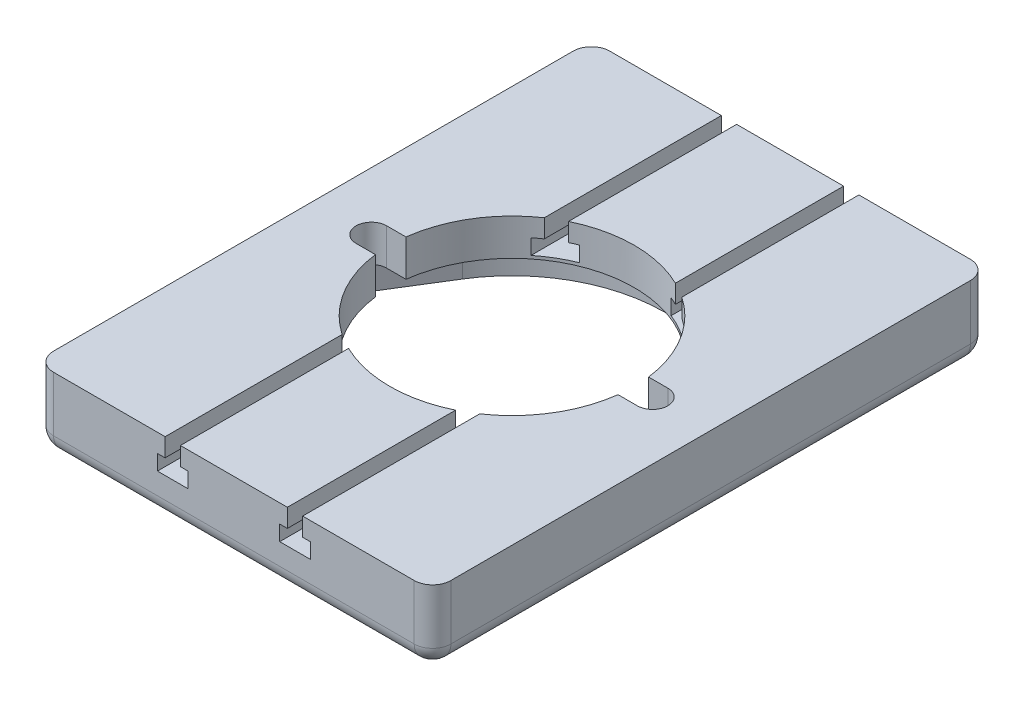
SolidWorks part; units mm, degrees
ref_plane "Plan de face" through (0, 0, 0) normal (0, 0, 1) x (1, 0, 0)
ref_plane "Plan de dessus" through (0, 0, 0) normal (0, 1, 0) x (1, 0, 0)
ref_plane "Plan de droite" through (0, 0, 0) normal (1, 0, 0) x (0, 0, -1)
sketch "Esquisse2" plane through (0, 0, 0) normal (0, 1, 0) x (1, 0, 0)
  line L1 (-325, -455) -> (325, -455)
  line L2 (-325, -455) -> (-325, 455)
  line L3 (-325, 455) -> (325, 455)
  line L4 (325, -455) -> (325, 455)
  line L5 (-325, -455) -> (325, 455) construction
  line L6 (-325, 455) -> (325, -455) construction
  point P0 (0, 0)
  dimension "D1" = 910
  dimension "D2" = 650
extrude "Boss.-Extru.1" add sketch "Esquisse2" against normal blind 120
fillet "Congé1" radius 30 8 edges at (0, -120, -455) (-325, -120, 0) (0, -120, 455) (325, -120, 0) (-325, -60, -455) (325, -60, -455) (325, -60, 455) (-325, -60, 455)
sketch "Esquisse3" plane through (0, 0, 0) normal (0, 1, 0) x (1, 0, 0)
  circle A0 centre (0, 0) radius 200
  dimension "D1" = 400
extrude "Enlèv. mat.-Extru.1" cut sketch "Esquisse3" against normal up to next
sketch "Esquisse4" plane through (0, 0, 0) normal (0, 1, 0) x (1, 0, 0)
  line L0 (-230, 0) -> (230, 0) construction
  line L1 (-230, 25) -> (230, 25)
  line L2 (-230, -25) -> (230, -25)
  arc A0 (-230, 25) -> (-230, -25) centre (-230, 0) ccw
  arc A1 (230, -25) -> (230, 25) centre (230, 0) ccw
  point P3 (0, 0)
  dimension "D2" = 230
  dimension "D1" = 50
extrude "Enlèv. mat.-Extru.2" cut sketch "Esquisse4" against normal up to next
sketch "Esquisse5" plane through (0, -120, 0) normal (0, -1, 0) x (1, 0, 0)
  line L0 (0, 0) -> (0, 250) construction
  line L1 (212.5, 131.6957) -> (268, 42.1426)
  line L2 (212.5, -131.6957) -> (268, -42.1426)
  line L3 (0, 0) -> (0, -250) construction
  line L4 (-212.5, -131.6957) -> (-268, -42.1426)
  line L5 (-212.5, 131.6957) -> (-268, 42.1426)
  arc A0 (212.5, 131.6957) -> (-212.5, 131.6957) centre (0, 0) ccw
  arc A1 (268, -42.1426) -> (268, 42.1426) centre (200, 0) ccw
  arc A2 (-212.5, -131.6957) -> (212.5, -131.6957) centre (0, 0) ccw
  arc A3 (-268, -42.1426) -> (-268, 42.1426) centre (-200, 0) cw
  dimension "D1" = 500
  dimension "D2" = 560
  dimension "D3" = 80
extrude "Enlèv. mat.-Extru.3" cut sketch "Esquisse5" against normal offset from surface (60 mm away) 60
fillet "Congé2" radius 5 8 edges at (-240.25, -60, 86.9191) (-280, -60, 0) (-240.25, -60, -86.9191) (0, -60, -250) (240.25, -60, -86.9191) (280, -60, 0) (240.25, -60, 86.9191) (0, -60, 250)
sketch "Esquisse6" plane through (0, 0, 455) normal (0, 0, 1) x (1, 0, 0)
  line L1 (-295, 0) -> (295, 0) construction
  line L2 (112.5, 0) -> (87.5, 0)
  line L3 (112.5, 0) -> (112.5, -30)
  line L4 (87.5, -30) -> (75, -30)
  line L5 (87.5, 0) -> (87.5, -30)
  line L6 (100, 0) -> (100, -55) construction
  line L7 (125, -30) -> (112.5, -30)
  line L8 (125, -30) -> (125, -55)
  line L9 (125, -55) -> (75, -55)
  line L10 (75, -30) -> (75, -55)
  line L11 (0, 0) -> (0, -156.4113) construction
  line L12 (-75, -30) -> (-75, -55)
  line L13 (-125, -55) -> (-75, -55)
  line L14 (-125, -30) -> (-125, -55)
  line L15 (-125, -30) -> (-112.5, -30)
  line L16 (-87.5, 0) -> (-87.5, -30)
  line L17 (-87.5, -30) -> (-75, -30)
  line L18 (-112.5, 0) -> (-112.5, -30)
  line L19 (-112.5, 0) -> (-87.5, 0)
  dimension "D1" = 100
  dimension "D2" = 25
  dimension "D3" = 50
  dimension "D4" = 30
  dimension "D5" = 25
extrude "Enlèv. mat.-Extru.4" cut sketch "Esquisse6" against normal through all
ref_plane "Rainure droite" through (100, 0, 0) normal (1, 0, 0) x (0, 0, -1)
ref_plane "Rainure gauche" through (-100, 0, 0) normal (1, 0, 0) x (0, 0, -1)
